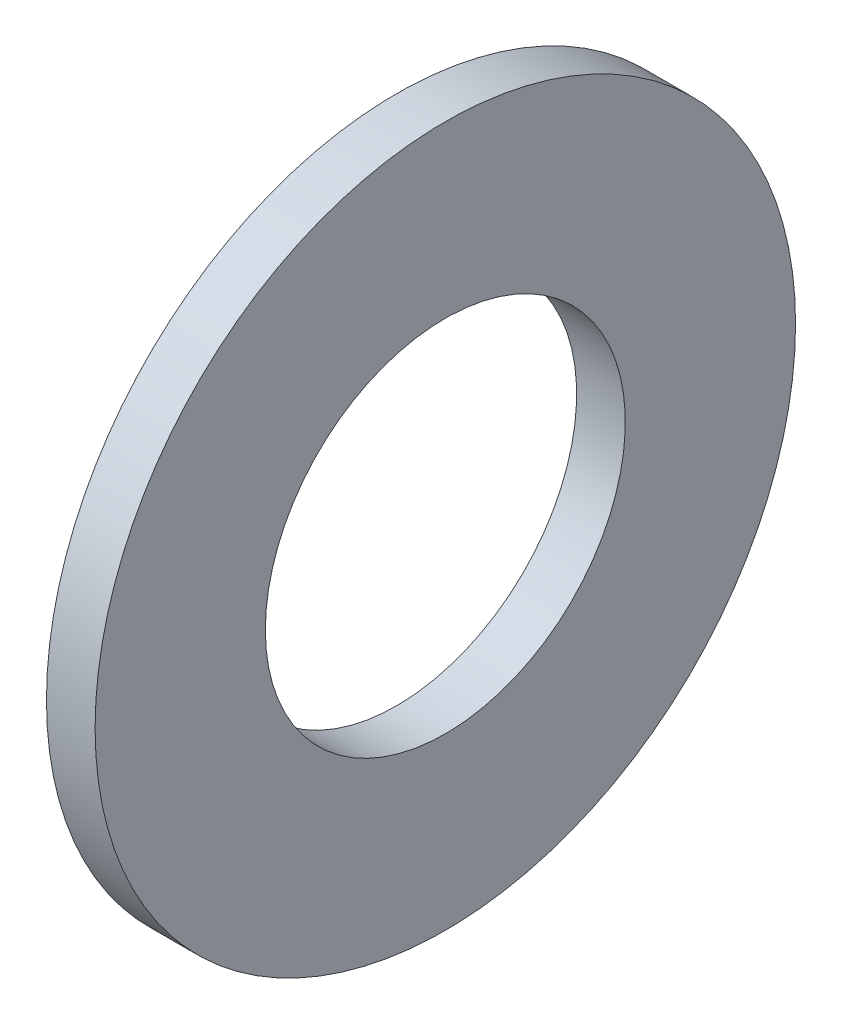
SolidWorks part; units mm, degrees
ref_plane "Plane1" through (0, 0, 0) normal (0, 0, 1) x (1, 0, 0)
ref_plane "Plane2" through (0, 0, 0) normal (0, 1, 0) x (1, 0, 0)
ref_plane "Plane3" through (0, 0, 0) normal (1, 0, 0) x (0, 0, -1)
other "Configuration Table"
sketch "Sketch1" plane through (0, 0, 0) normal (0, 0, 1) x (1, 0, 0)
  line L0 (-34.925, 0) -> (9.525, 0) construction
  line L1 (0, 18.5) -> (0, 36)
  line L2 (0, 36) -> (-5, 36)
  line L3 (-5, 36) -> (-5, 18.5)
  line L4 (-5, 18.5) -> (0, 18.5)
  dimension "Thickness" = 5
  dimension "Inside_dia" = 37
  dimension "Outside_dia" = 72
revolve "Base-Revolve" add sketch "Sketch1" angle 360 about L0
